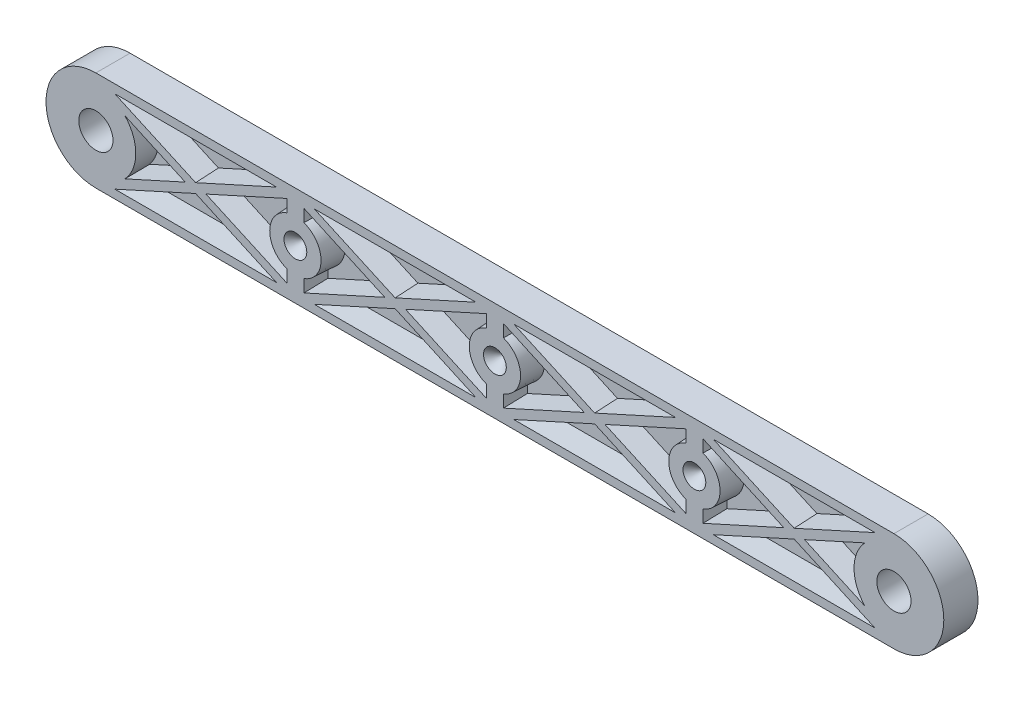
SolidWorks part; units mm, degrees
ref_plane "Face" through (0, 0, 0) normal (0, 0, 1) x (1, 0, 0)
ref_plane "Dessus" through (0, 0, 0) normal (0, 1, 0) x (1, 0, 0)
ref_plane "Droite" through (0, 0, 0) normal (1, 0, 0) x (0, 0, -1)
sketch "Esquisse1" plane through (0, 0, 0) normal (0, 0, 1) x (1, 0, 0)
  line L1 (-44.6814, 27.8359) -> (235.3186, 27.8359)
  line L3 (-44.6814, -7.1641) -> (235.3186, -7.1641)
  arc A0 (-44.6814, 27.8359) -> (-44.6814, -7.1641) centre (-44.6814, 10.3359) ccw
  arc A2 (235.3186, -7.1641) -> (235.3186, 27.8359) centre (235.3186, 10.3359) ccw
  dimension "D1" = 35
  dimension "D2" = 280
extrude "Base-Extrusion" add sketch "Esquisse1" along normal blind 12
sketch "Esquisse2" plane through (0, 0, 12) normal (0, 0, 1) x (1, 0, 0)
  line L0 (95.3186, 27.8359) -> (95.3186, -7.1641) construction
  line L1 (235.3186, 27.8359) -> (-44.6814, 27.8359) construction
  line L2 (-44.6814, -7.1641) -> (235.3186, -7.1641) construction
  line L3 (98.3186, 23.1891) -> (98.3186, 18.8212)
  line L4 (101.953, -4.1641) -> (158.6843, -4.1641)
  line L5 (165.3186, 27.8359) -> (165.3186, -7.1641) construction
  line L6 (158.6843, 24.8359) -> (101.953, 24.8359)
  line L7 (162.3186, 23.1891) -> (162.3186, 18.8212)
  line L8 (162.3186, 1.8506) -> (162.3186, -2.5173)
  line L9 (98.3186, 1.8506) -> (98.3186, -2.5173)
  line L10 (158.6843, 24.8359) -> (130.3186, 11.9827)
  line L11 (158.6843, 24.8359) -> (162.3186, 24.8359) construction
  line L12 (101.953, -4.1641) -> (130.3186, 8.6891)
  line L13 (162.3186, 23.1891) -> (162.3186, 24.8359) construction
  line L14 (98.3186, -2.5173) -> (98.3186, -4.1641) construction
  line L15 (162.3186, 24.8359) -> (98.3186, -4.1641) construction
  line L16 (101.953, -4.1641) -> (98.3186, -4.1641) construction
  line L17 (101.953, 24.8359) -> (130.3186, 11.9827)
  line L18 (133.953, 10.3359) -> (162.3186, 23.1891)
  line L19 (158.6843, -4.1641) -> (130.3186, 8.6891)
  line L20 (126.6843, 10.3359) -> (98.3186, -2.5173)
  line L21 (133.953, 10.3359) -> (162.3186, -2.5173)
  line L22 (126.6843, 10.3359) -> (98.3186, 23.1891)
  line L23 (101.953, -4.1641) -> (101.953, 24.8359) construction
  arc A0 (98.3186, 1.8506) -> (98.3186, 18.8212) centre (95.3186, 10.3359) ccw
  arc A1 (162.3186, 18.8212) -> (162.3186, 1.8506) centre (165.3186, 10.3359) ccw
  dimension "D3" = 18
  dimension "D1" = 3
  dimension "D2" = 3
  dimension "D4" = 3
  dimension "D5" = 70
  dimension "D6" = 3
  dimension "D7" = 3
  dimension "D8" = 1.5
extrude "Enlèv. mat.-Extru.1" cut sketch "Esquisse2" against normal blind 8 draft 3
sketch "Esquisse3" plane through (0, 0, 12) normal (0, 0, 1) x (1, 0, 0)
  circle A0 centre (95.3186, 10.3359) radius 4
  dimension "D1" = 8
extrude "Enlèv. mat.-Extru.2" cut sketch "Esquisse3" against normal through all draft 45
pattern_linear "Répétition linéaire1" count 2 spacing 70 along (1, 0, 0) of "Enlèv. mat.-Extru.1", "Enlèv. mat.-Extru.2"
pattern_linear "Répétition linéaire2" count 3 spacing 70 along (-1, 0, 0) of "Enlèv. mat.-Extru.2", "Enlèv. mat.-Extru.1"
sketch "Esquisse4" plane through (0, 0, 12) normal (0, 0, 1) x (1, 0, 0)
  circle A0 centre (-44.6814, 10.3359) radius 14
  circle A1 centre (235.3186, 10.3359) radius 14
  arc A2 (-44.6814, 27.8359) -> (-44.6814, -7.1641) centre (-44.6814, 10.3359) ccw construction
  arc A3 (235.3186, -7.1641) -> (235.3186, 27.8359) centre (235.3186, 10.3359) ccw construction
  dimension "D1" = 28
extrude "Boss.-Extru.2" add sketch "Esquisse4" against normal through all
sketch "Esquisse5" plane through (0, 0, 12) normal (0, 0, 1) x (1, 0, 0)
  circle A0 centre (-44.6814, 10.3359) radius 6
  circle A1 centre (235.3186, 10.3359) radius 6
  dimension "D1" = 12
extrude "Enlèv. mat.-Extru.3" cut sketch "Esquisse5" against normal through all
sketch "Esquisse6" plane through (0, 0, 0) normal (0, 0, -1) x (-1, 0, 0)
  circle A0 centre (-235.3186, 10.3359) radius 12.5
  dimension "D1" = 25
extrude "Enlèv. mat.-Extru.4" cut sketch "Esquisse6" against normal blind 2
